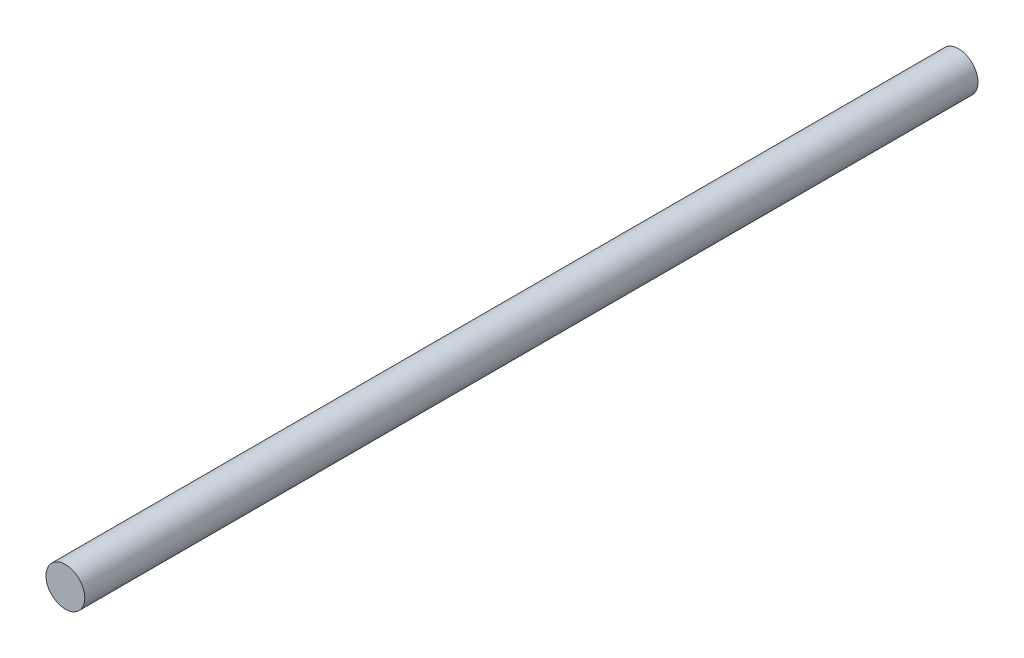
SolidWorks part; units mm, degrees
ref_plane "Front Plane" through (0, 0, 0) normal (0, 0, 1) x (1, 0, 0)
ref_plane "Top Plane" through (0, 0, 0) normal (0, 1, 0) x (1, 0, 0)
ref_plane "Right Plane" through (0, 0, 0) normal (1, 0, 0) x (0, 0, -1)
sketch "Sketch1" plane through (0, 0, 0) normal (0, 0, 1) x (1, 0, 0)
  circle A0 centre (0, 0) radius 6.35
  dimension "D1" = 12.7
extrude "Extrude1" add sketch "Sketch1" along normal blind 292.1
